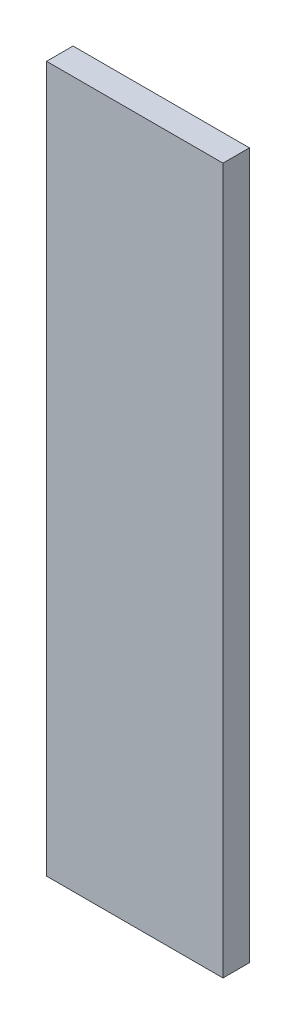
SolidWorks part; units mm, degrees
ref_plane "Face" through (0, 0, 0) normal (0, 0, 1) x (1, 0, 0)
ref_plane "Dessus" through (0, 0, 0) normal (0, 1, 0) x (1, 0, 0)
ref_plane "Droite" through (0, 0, 0) normal (1, 0, 0) x (0, 0, -1)
sketch "Esquisse1" plane through (0, 0, 0) normal (0, 0, 1) x (1, 0, 0)
  line L1 (0, 60.9023) -> (20, 60.9023)
  line L2 (0, 60.9023) -> (0, -19.0977)
  line L3 (0, -19.0977) -> (20, -19.0977)
  line L4 (20, 60.9023) -> (20, -19.0977)
  dimension "D1" = 20
  dimension "D2" = 80
extrude "Extrusion1" add sketch "Esquisse1" along normal blind 3
